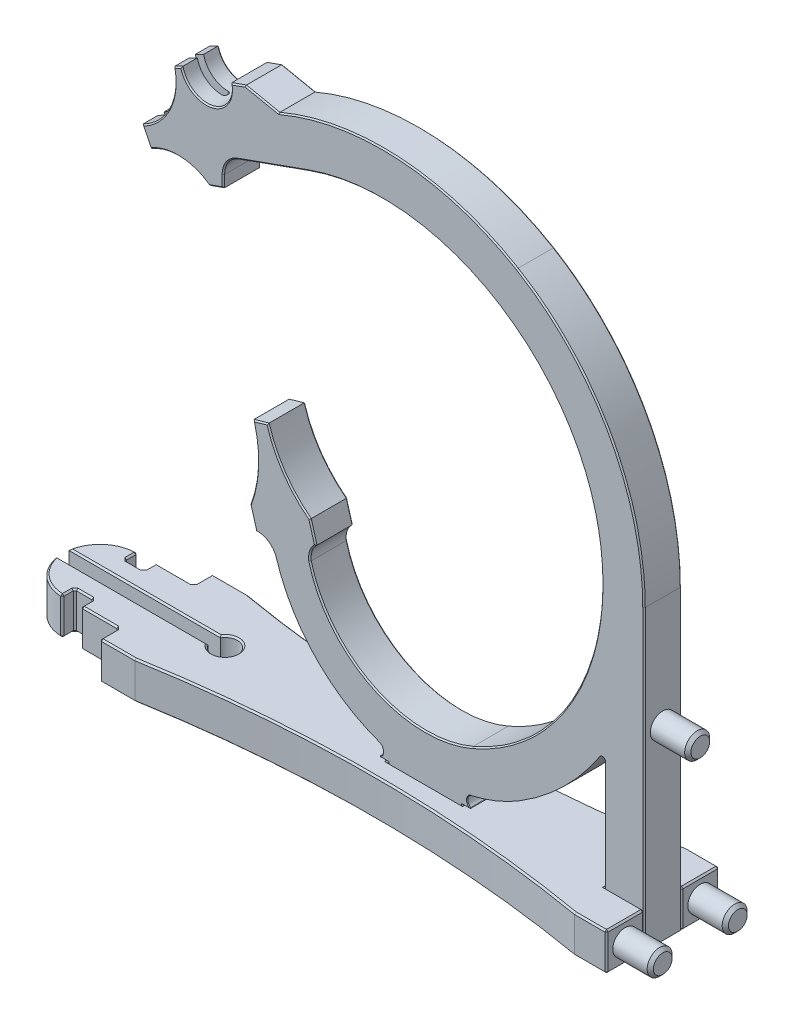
SolidWorks part; units mm, degrees
ref_plane "Спереди" through (0, 0, 0) normal (0, 0, 1) x (1, 0, 0)
ref_plane "Сверху" through (0, 0, 0) normal (0, 1, 0) x (1, 0, 0)
ref_plane "Справа" through (0, 0, 0) normal (1, 0, 0) x (0, 0, -1)
sketch "Эскиз1" plane through (0, 0, 0) normal (0, 0, 1) x (1, 0, 0)
  line L0 (70, 28.3951) -> (70, -104.7432) construction
  line L1 (5.0719, -9.2042) -> (16.3815, -5.1615)
  line L2 (0, 0) -> (6.25, 0) construction
  line L3 (0, 0) -> (0, -12.5) construction
  line L4 (0, -12.5) -> (6.25, -12.5) construction
  line L5 (6.25, 0) -> (6.25, -12.5) construction
  line L6 (2.75, -12.5) -> (2.75, -14.3457)
  line L7 (3.919, 0.8009) -> (6.25, 1.6342)
  line L8 (3.919, 0.8009) -> (0, -0.6) construction
  line L9 (6.25, 1.6342) -> (11.5914, 0.528)
  line L10 (0.5, -15.15) -> (2.75, -14.3457)
  line L11 (0, 0) -> (0.5, 0) construction
  line L12 (0, 0) -> (0, -15.15) construction
  line L13 (0, -15.15) -> (0.5, -15.15) construction
  line L14 (0.5, 0) -> (0.5, -15.15) construction
  line L15 (-14.5, -3.5) -> (-14.5, -13) construction
  line L16 (-10.2463, -11.9945) -> (-8.8737, -14.7355)
  line L17 (-5.2129, -1.5) -> (-3.9093, -0.8472)
  line L18 (-14.5, -3.5) -> (-5, -3.5) construction
  line L19 (35, -54.3564) -> (35, -86.559) construction
  line L20 (11.7682, 3.931) -> (58.9738, 3.931) construction
  line L21 (28.275, -77.0452) -> (28.275, -86.559) construction
  line L22 (29, -80.559) -> (27.2592, -80.559)
  line L23 (41, -80.559) -> (42.7408, -80.559)
  line L24 (41.725, -77.0452) -> (41.725, -86.559) construction
  line L25 (29, -80.559) -> (29, -86.559)
  line L26 (29, -86.559) -> (35, -86.559)
  line L27 (41, -80.559) -> (41, -86.559)
  line L28 (41, -86.559) -> (35, -86.559)
  line L29 (70, -38.85) -> (70, -86.559)
  line L30 (70, -86.559) -> (63.85, -86.559)
  line L31 (63.85, -86.559) -> (63.85, -63.1737)
  line L32 (7.4685, -44.053) -> (9.8716, -43.3639)
  line L33 (8.6701, -43.7085) -> (17.2347, -73.5768) construction
  line L34 (7.9109, -59.2009) -> (6.9876, -55.9807)
  line L35 (17.5236, -56.4445) -> (16.6002, -53.2243)
  arc A0 (-3.9093, -0.8472) -> (3.919, 0.8009) centre (0, 0) ccw
  arc A1 (62.1178, -29.6308) -> (16.3815, -5.1615) centre (28.1627, -38.119) ccw
  arc A2 (5.0719, -9.2042) -> (2.75, -12.5) centre (6.25, -12.5) ccw
  arc A5 (0.5, -15.15) -> (-8.8737, -14.7355) centre (-4.5, -22.0239) ccw
  arc A6 (-10.2463, -11.9945) -> (-5.2129, -1.5) centre (-14.5, -3.5) ccw
  arc A7 (16.5978, -59.085) -> (42.5161, -71.8065) centre (35, -54.3564) ccw
  arc A8 (11.1328, -61.3165) -> (27.6037, -78.5876) centre (36.6653, -53.4564) ccw
  arc A9 (27.2592, -80.559) -> (27.6037, -78.5876) centre (27.2592, -79.5432) ccw
  arc A10 (42.7408, -80.559) -> (42.3963, -78.5876) centre (42.7408, -79.5432) cw
  arc A11 (42.3963, -78.5876) -> (50.1898, -75.3998) centre (36.6653, -53.4564) ccw
  circle A12 centre (35, -54.3564) radius 22.375 construction
  arc A13 (6.9876, -55.9807) -> (7.4685, -44.053) centre (-10.7955, -49.2901) ccw
  arc A14 (16.6002, -53.2243) -> (9.8716, -43.3639) centre (28.1356, -38.1268) cw
  arc A16 (11.1495, -61.3726) -> (7.9109, -59.2009) centre (8.2432, -62.206) ccw
  arc A17 (17.5236, -56.4445) -> (16.5978, -59.085) centre (19.59, -58.6515) ccw
  arc A18 (62.931, -62.9008) -> (63.85, -63.1737) centre (63.35, -63.1737) cw
  arc A19 (49.6976, -2.0019) -> (11.5914, 0.528) centre (28.1627, -38.119) ccw
  ellipse E0 centre (30.25, -38.85) end of major axis (30.25, -74.35) minor radius 33 (42.5161, -71.8065) -> (62.1178, -29.6308) ccw
  ellipse E1 centre (30.25, -38.85) end of major axis (30.25, 3.4) minor radius 39.75 (50.1898, -75.3998) -> (62.931, -62.9008) ccw
  ellipse E2 centre (30.25, -38.85) end of major axis (30.25, 3.4) minor radius 39.75 (70, -38.85) -> (49.6976, -2.0019) ccw
  ellipse E3 centre (30.25, -38.85) end of major axis (30.25, 3.4) minor radius 39.75 (50.1898, -75.3998) -> (62.931, -62.9008) ccw
  point P26 (-45.7989, -56.2235)
  dimension "D1" = 8
  dimension "D9" = 70
  dimension "D8" = 7
  dimension "D11" = 12.5
  dimension "D12" = 90.49
  dimension "D18" = 17
  dimension "D20" = 19
  dimension "D26" = 38
  dimension "D34" = 44.75
  dimension "D38" = 3.0235
  dimension "D39" = 0.5
  dimension "D7" = 42.05
  dimension "D28" = 0.9
  dimension "D40" = 26.715
  dimension "D41" = 6.3781
  dimension "D2" = 30.25
  dimension "D3" = 66
  dimension "D4" = 71
  dimension "D5" = 38.85
  dimension "D6" = 70
  dimension "D10" = 6.25
  dimension "D13" = 0.6
  dimension "D14" = 11.7
  dimension "D15" = 84.5
  dimension "D16" = 0.5
  dimension "D17" = 15.15
  dimension "D19" = 4.5
  dimension "D21" = 3.5
  dimension "D22" = 14.5
  dimension "D23" = 26.6
  dimension "D24" = 1.5
  dimension "D25" = 26.6
  dimension "D27" = 4.75
  dimension "D29" = 6.725
  dimension "D30" = 6
  dimension "D31" = 12
  dimension "D32" = 6.15
  dimension "D33" = 16
  dimension "D35" = 2.5
  dimension "D36" = 10
  dimension "D37" = 3.35
extrude "Бобышка-Вытянуть1" add sketch "Эскиз1" along normal blind 6
fillet "Скругление1" radius 0.1 2 edges at (42.7408, -80.559, 3) (27.2592, -80.559, 3)
sketch "Эскиз2" plane through (70, 0, 0) normal (1, 0, 0) x (0, 0, -1)
  line L0 (-6, -86.559) -> (0, -86.559) construction
  circle A0 centre (-3, -56.559) radius 2
  point P2 (-3, -86.559)
  dimension "D1" = 4
  dimension "D2" = 3
  dimension "D3" = 30
extrude "Бобышка-Вытянуть2" add sketch "Эскиз2" along normal blind 6
chamfer "Фаска1" distance 0.5 angle 45 1 edges at (76, -54.559, 3)
sketch "Эскиз3" plane through (0, 0, 0) normal (0, 1, 0) x (1, 0, 0)
  line L0 (-10.2463, -6) -> (-10.2463, 0) construction
  line L1 (-10.2463, -2.5) -> (0, -2.5)
  line L2 (-10.2463, -2.5) -> (-10.2463, -3.5)
  line L3 (-10.2463, -3.5) -> (0, -3.5)
  arc A0 (0, -3.5) -> (0, -2.5) centre (0, -3) ccw
  dimension "D1" = 1
  dimension "D2" = 2.5
extrude "Вырез-Вытянуть1" cut sketch "Эскиз3" against normal blind 16
chamfer "Фаска2" distance 0.2 angle 45 51 edges at (1.625, -14.7479, 0) (-4.1245, -13.5322, 0) (-9.56, -13.365, 0) (-5.9343, -7.6083, 0) (-4.5611, -1.1736, 0) (0.8241, -3.9142, 0) (5.0845, 1.2175, 0) (8.9207, 1.0811, 0) (2.75, -13.4229, 0) (3.3888, -10.4842, 0) (10.7267, -7.1828, 0) (16.7369, -57.6512, 0) (44.6735, -7.2582, 0) (59.7664, -54.7254, 0) (26.6283, -71.4126, 0) (41, -83.559, 6) (7.4493, -57.5908, 0) (8.1891, -50.0556, 0) (17.0619, -54.8344, 0) (12.4414, -48.8362, 0) (7.4493, -57.5908, 6) (8.1891, -50.0556, 6) (8.6701, -43.7085, 6) (12.4414, -48.8362, 6) (17.0619, -54.8344, 6) (64.5509, -17.4991, 0) (70, -62.7045, 0) (66.925, -86.559, 6) (16.7369, -57.6512, 6) (26.6283, -71.4126, 6) (59.7664, -54.7254, 6) (44.6735, -7.2582, 6) (10.7267, -7.1828, 6) (70, -62.7045, 6) (3.3888, -10.4842, 6) (64.5509, -17.4991, 6) (2.75, -13.4229, 6) (1.625, -14.7479, 6) (-4.1245, -13.5322, 6) (-9.56, -13.365, 6) (8.9207, 1.0811, 6) (5.0845, 1.2175, 6) (0.8241, -3.9142, 6) (-4.5611, -1.1736, 6) (-5.9343, -7.6083, 6) (30.9483, 3.8386, 0) (30.9483, 3.8386, 6) (41, -83.559, 0) (29, -83.559, 6) (29, -83.559, 0) (8.6701, -43.7085, 0)
chamfer "Фаска3" distance 0.2 angle 45 11 edges at (35, -86.559, 0) (29, -86.559, 3) (41, -86.559, 3) (40.9, -86.559, 5.9) (35, -86.559, 6) (29.1, -86.559, 0.1) (29.1, -86.559, 5.9) (40.9, -86.559, 0.1) (70, -86.559, 3) (63.85, -86.559, 2.9) (66.825, -86.559, 0)
chamfer "Фаска4" distance 0.1 angle 45 16 edges at (9.9871, -59.7362, 0) (17.3324, -71.8935, 0) (28.2663, -79.4105, 0) (27.8012, -80.489, 0) (28.5483, -80.559, 0) (41.4517, -80.559, 0) (42.1988, -80.489, 0) (41.7337, -79.4105, 0) (41.7337, -79.4105, 6) (42.1988, -80.489, 6) (41.4517, -80.559, 6) (28.5483, -80.559, 6) (27.8012, -80.489, 6) (28.2663, -79.4105, 6) (17.3324, -71.8935, 6) (9.9871, -59.7362, 6)
sketch "Эскиз4" plane through (0, -86.559, 0) normal (0, -1, 0) x (1, 0, 0)
  line L0 (76, 3) -> (-20, 3) construction
  line L1 (76, 1.5) -> (76, 4.5) construction
  line L2 (-25.9161, 2) -> (-1.7321, 2)
  line L3 (-25.9161, 4) -> (-1.7321, 4)
  line L4 (-20, 9) -> (-20, 7)
  line L5 (-20, 7) -> (-17, 7)
  line L6 (-17, 7) -> (-17, 9)
  line L7 (-17, 9) -> (-11, 9)
  line L8 (-11, 9) -> (-11, 12)
  line L9 (-20, -3) -> (-20, -1)
  line L10 (-20, -1) -> (-17, -1)
  line L11 (-17, -1) -> (-17, -3)
  line L12 (-17, -3) -> (-11, -3)
  line L13 (-11, -3) -> (-11, -6)
  line L14 (-11, 12) -> (-5.4, 12)
  line L15 (-11, -6) -> (-5.4, -6)
  line L16 (63.85, 0) -> (63.85, 6)
  line L19 (63.85, 6) -> (70, 6)
  line L20 (70, 6) -> (70, 12)
  line L22 (70, 12) -> (64.9, 12)
  line L23 (-5.4, 9) -> (64.9, 9) construction
  line L24 (63.85, 0) -> (70, 0)
  line L25 (70, 0) -> (70, -6)
  line L26 (70, -6) -> (64.9, -6)
  line L27 (-5.4, -3) -> (64.9, -3) construction
  line L28 (27.8966, 6) -> (29.2, 6) construction
  line L29 (29, 6) -> (41, 6)
  line L30 (29, 6) -> (29, 0)
  line L31 (29, 0) -> (41, 0)
  line L32 (41, 6) -> (41, 0)
  line L33 (29, 0.2) -> (29, 5.8) construction
  line L34 (41, 5.8) -> (41, 0.2) construction
  line L35 (40.8, 0) -> (29.2, 0) construction
  line L36 (63.85, 6) -> (63.85, 0) construction
  line L37 (70, 5.8) -> (70, 0.2) construction
  arc A0 (-5.4, 12) -> (64.9, 12) centre (29.75, 216.4204) ccw
  arc A1 (0, 2) -> (0, 4) centre (0, 3) ccw construction
  arc A2 (-25.9161, 2) -> (-20, -3) centre (-20, 3) ccw
  arc A3 (-20, 9) -> (-25.9161, 4) centre (-20, 3) ccw
  arc A4 (-5.4, -6) -> (64.9, -6) centre (29.75, -210.4204) cw
  arc A5 (-1.7321, 2) -> (-1.7321, 4) centre (0, 3) ccw
  arc A6 (0, 2.5) -> (0.5, 3) centre (0, 3) ccw construction
  point P41 (63.85, 3)
  dimension "D1" = 6
  dimension "D2" = 2
  dimension "D11" = 4
  dimension "D3" = 20
  dimension "D4" = 2
  dimension "D5" = 3
  dimension "D6" = 6
  dimension "D7" = 12
  dimension "D8" = 18
  dimension "D9" = 5.6
  dimension "D10" = 5.1
  dimension "D12" = 17
extrude "Бобышка-Вытянуть3" add sketch "Эскиз4" against normal blind 6 separate body
chamfer "Фаска5" distance 0.25 angle 45 76 edges at (41, -86.559, 3) (35, -86.559, 6) (29, -86.559, 3) (35, -86.559, 0) (35, -80.559, 6) (41, -80.559, 3) (35, -80.559, 0) (29, -80.559, 3) (-17, -83.559, -1) (-20, -83.559, -1) (-20, -83.559, 7) (-17, -83.559, 7) (-8.2, -86.559, -6) (-11, -86.559, -4.5) (-14, -86.559, -3) (-17, -86.559, -2) (-18.5, -86.559, -1) (-20, -86.559, -2) (-23.873, -86.559, -1.5826) (-13.8241, -86.559, 2) (2, -86.559, 3) (-13.8241, -86.559, 4) (-23.873, -86.559, 7.5826) (-20, -86.559, 8) (-18.5, -86.559, 7) (-17, -86.559, 8) (-14, -86.559, 9) (-11, -86.559, 10.5) (-8.2, -86.559, 12) (29.75, -86.559, 9) (67.45, -86.559, 12) (70, -86.559, 9) (66.925, -86.559, 6) (63.85, -86.559, 3) (66.925, -86.559, 0) (70, -86.559, -3) (29.75, -86.559, -3) (67.45, -86.559, -6) (67.45, -80.559, -6) (70, -83.559, -6) (70, -80.559, -3) (70, -83.559, 0) (66.925, -80.559, 0) (63.85, -80.559, 3) (66.925, -80.559, 6) (70, -83.559, 6) (70, -80.559, 9) (70, -83.559, 12) (67.45, -80.559, 12) (29.75, -80.559, 9) (-8.2, -80.559, 12) (-11, -83.559, 12) (-11, -80.559, 10.5) (-11, -83.559, 9) (-14, -80.559, 9) (29.75, -80.559, -3) (-8.2, -80.559, -6) (-11, -83.559, -6) (-11, -80.559, -4.5) (-11, -83.559, -3) (-14, -80.559, -3) (-17, -83.559, -3) (-17, -80.559, -2) (-18.5, -80.559, -1) (-20, -80.559, -2) (-20, -83.559, -3) (-23.873, -80.559, -1.5826) (-13.8241, -80.559, 2) (2, -80.559, 3) (-13.8241, -80.559, 4) (-23.873, -80.559, 7.5826) (-20, -83.559, 9) (-20, -80.559, 8) (-18.5, -80.559, 7) (-17, -80.559, 8) (-17, -83.559, 9)
sketch "Эскиз5" plane through (70, 0, 0) normal (1, 0, 0) x (0, 0, -1)
  line L1 (-9, -83.559) -> (-3, -83.559) construction
  line L2 (-3, -83.559) -> (3, -83.559) construction
  line L3 (-3, -56.559) -> (-3, -83.559) construction
  line L4 (-6.25, -86.559) -> (-11.75, -86.559) construction
  circle A0 centre (-9, -83.559) radius 2
  circle A1 centre (3, -83.559) radius 2
  dimension "D1" = 4
  dimension "D2" = 3
  dimension "D3" = 12
extrude "Бобышка-Вытянуть4" add sketch "Эскиз5" along normal blind 6
chamfer "Фаска6" distance 0.5 angle 45 2 edges at (76, -83.559, -5) (76, -83.559, 7)
